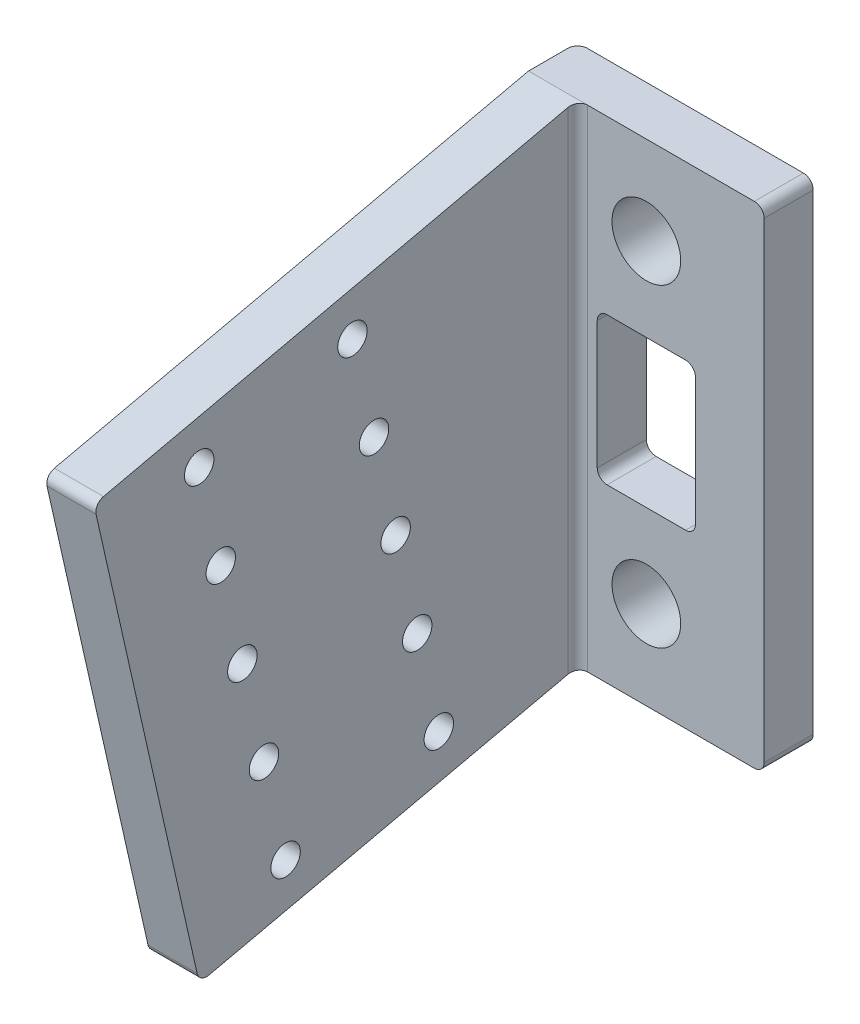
SolidWorks part; units mm, degrees
ref_plane "Front Plane" through (0, 0, 0) normal (0, 0, 1) x (1, 0, 0)
ref_plane "Top Plane" through (0, 0, 0) normal (0, 1, 0) x (1, 0, 0)
ref_plane "Right Plane" through (0, 0, 0) normal (1, 0, 0) x (0, 0, -1)
body saved out of another part "Stock-storage_space_to_ac_box_bracket_left-1"
fillet "Fillet1" radius 1 10 edges at (95, -33.69, 43.5322) (95, 13.89, 54.2627) (92.5, 0, 0) (99.5, 7.5, 2.5) (99.5, -7.5, 2.5) (109.5, -7.5, 2.5) (109.5, 7.5, 2.5) (116.5, 25, 2.5) (116.5, -25, 2.5) (97.5, 0, 5)
